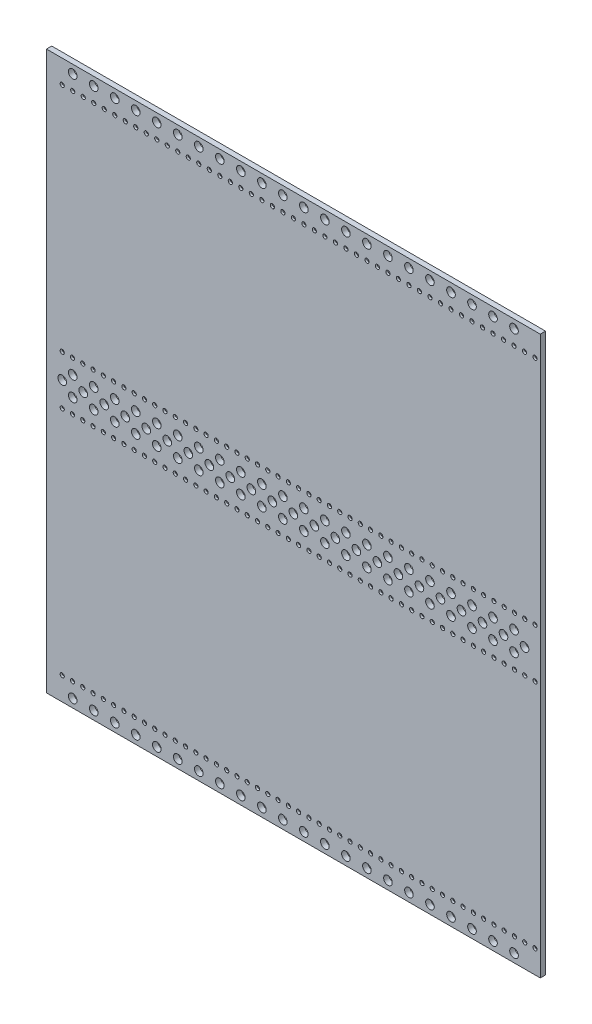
SolidWorks part; units mm, degrees
ref_plane "前视基准面" through (0, 0, 0) normal (0, 0, 1) x (1, 0, 0)
ref_plane "上视基准面" through (0, 0, 0) normal (0, 1, 0) x (1, 0, 0)
ref_plane "右视基准面" through (0, 0, 0) normal (1, 0, 0) x (0, 0, -1)
sketch "草图1" plane through (0, 0, 0) normal (0, 0, 1) x (1, 0, 0)
  line L1 (-117.5, 132.675) -> (117.5, 132.675)
  line L2 (-117.5, 132.675) -> (-117.5, -132.675)
  line L3 (-117.5, -132.675) -> (117.5, -132.675)
  line L4 (117.5, 132.675) -> (117.5, -132.675)
  line L5 (-117.5, 132.675) -> (117.5, -132.675) construction
  line L6 (-117.5, -132.675) -> (117.5, 132.675) construction
  circle A0 centre (-105, 128.675) radius 2.05
  circle A1 centre (-95, 128.675) radius 2.05
  circle A2 centre (-85, 128.675) radius 2.05
  circle A3 centre (-75, 128.675) radius 2.05
  circle A4 centre (-65, 128.675) radius 2.05
  circle A5 centre (-55, 128.675) radius 2.05
  circle A6 centre (-45, 128.675) radius 2.05
  circle A7 centre (-35, 128.675) radius 2.05
  circle A8 centre (-25, 128.675) radius 2.05
  circle A9 centre (-15, 128.675) radius 2.05
  circle A10 centre (-5, 128.675) radius 2.05
  circle A11 centre (5, 128.675) radius 2.05
  circle A12 centre (15, 128.675) radius 2.05
  circle A13 centre (25, 128.675) radius 2.05
  circle A14 centre (35, 128.675) radius 2.05
  circle A15 centre (45, 128.675) radius 2.05
  circle A16 centre (55, 128.675) radius 2.05
  circle A17 centre (65, 128.675) radius 2.05
  circle A18 centre (75, 128.675) radius 2.05
  circle A19 centre (85, 128.675) radius 2.05
  circle A20 centre (95, 128.675) radius 2.05
  circle A21 centre (105, 128.675) radius 2.05
  circle A23 centre (-105, 4.675) radius 2.05
  circle A24 centre (-105, -4.675) radius 2.05
  circle A25 centre (-105, -128.675) radius 2.05
  circle A26 centre (-95, 4.675) radius 2.05
  circle A27 centre (-95, -4.675) radius 2.05
  circle A28 centre (-95, -128.675) radius 2.05
  circle A29 centre (-85, 4.675) radius 2.05
  circle A30 centre (-85, -4.675) radius 2.05
  circle A31 centre (-85, -128.675) radius 2.05
  circle A32 centre (-75, 4.675) radius 2.05
  circle A33 centre (-75, -4.675) radius 2.05
  circle A34 centre (-75, -128.675) radius 2.05
  circle A35 centre (-65, 4.675) radius 2.05
  circle A36 centre (-65, -4.675) radius 2.05
  circle A37 centre (-65, -128.675) radius 2.05
  circle A38 centre (-55, 4.675) radius 2.05
  circle A39 centre (-55, -4.675) radius 2.05
  circle A40 centre (-55, -128.675) radius 2.05
  circle A41 centre (-45, 4.675) radius 2.05
  circle A42 centre (-45, -4.675) radius 2.05
  circle A43 centre (-45, -128.675) radius 2.05
  circle A44 centre (-35, 4.675) radius 2.05
  circle A45 centre (-35, -4.675) radius 2.05
  circle A46 centre (-35, -128.675) radius 2.05
  circle A47 centre (-25, 4.675) radius 2.05
  circle A48 centre (-25, -4.675) radius 2.05
  circle A49 centre (-25, -128.675) radius 2.05
  circle A50 centre (-15, 4.675) radius 2.05
  circle A51 centre (-15, -4.675) radius 2.05
  circle A52 centre (-15, -128.675) radius 2.05
  circle A53 centre (-5, 4.675) radius 2.05
  circle A54 centre (-5, -4.675) radius 2.05
  circle A55 centre (-5, -128.675) radius 2.05
  circle A56 centre (5, 4.675) radius 2.05
  circle A57 centre (5, -4.675) radius 2.05
  circle A58 centre (5, -128.675) radius 2.05
  circle A59 centre (15, 4.675) radius 2.05
  circle A60 centre (15, -4.675) radius 2.05
  circle A61 centre (15, -128.675) radius 2.05
  circle A62 centre (25, 4.675) radius 2.05
  circle A63 centre (25, -4.675) radius 2.05
  circle A64 centre (25, -128.675) radius 2.05
  circle A65 centre (35, 4.675) radius 2.05
  circle A66 centre (35, -4.675) radius 2.05
  circle A67 centre (35, -128.675) radius 2.05
  circle A68 centre (45, 4.675) radius 2.05
  circle A69 centre (45, -4.675) radius 2.05
  circle A70 centre (45, -128.675) radius 2.05
  circle A71 centre (55, 4.675) radius 2.05
  circle A72 centre (55, -4.675) radius 2.05
  circle A73 centre (55, -128.675) radius 2.05
  circle A74 centre (65, 4.675) radius 2.05
  circle A75 centre (65, -4.675) radius 2.05
  circle A76 centre (65, -128.675) radius 2.05
  circle A77 centre (75, 4.675) radius 2.05
  circle A78 centre (75, -4.675) radius 2.05
  circle A79 centre (75, -128.675) radius 2.05
  circle A80 centre (85, 4.675) radius 2.05
  circle A81 centre (85, -4.675) radius 2.05
  circle A82 centre (85, -128.675) radius 2.05
  circle A83 centre (95, 4.675) radius 2.05
  circle A84 centre (95, -4.675) radius 2.05
  circle A85 centre (95, -128.675) radius 2.05
  circle A86 centre (105, 4.675) radius 2.05
  circle A87 centre (105, -4.675) radius 2.05
  circle A88 centre (105, -128.675) radius 2.05
  circle A92 centre (-110, 0) radius 2.05
  circle A93 centre (-100, 0) radius 2.05
  circle A94 centre (-90, 0) radius 2.05
  circle A95 centre (-80, 0) radius 2.05
  circle A96 centre (-70, 0) radius 2.05
  circle A97 centre (-60, 0) radius 2.05
  circle A98 centre (-50, 0) radius 2.05
  circle A99 centre (-40, 0) radius 2.05
  circle A100 centre (-30, 0) radius 2.05
  circle A101 centre (-20, 0) radius 2.05
  circle A102 centre (-10, 0) radius 2.05
  circle A103 centre (0, 0) radius 2.05
  circle A104 centre (10, 0) radius 2.05
  circle A105 centre (20, 0) radius 2.05
  circle A106 centre (30, 0) radius 2.05
  circle A107 centre (40, 0) radius 2.05
  circle A108 centre (50, 0) radius 2.05
  circle A109 centre (60, 0) radius 2.05
  circle A110 centre (70, 0) radius 2.05
  circle A111 centre (80, 0) radius 2.05
  circle A112 centre (90, 0) radius 2.05
  circle A113 centre (100, 0) radius 2.05
  circle A114 centre (110, 0) radius 2.05
  point P0 (0, 0)
extrude "凸台-拉伸1" add sketch "草图1" along normal mid plane 2.5
sketch "草图2" plane through (0, 0, 1.25) normal (0, 0, 1) x (1, 0, 0)
  line L0 (117.5, 132.675) -> (-117.5, 132.675) construction
  line L2 (-117.5, -132.675) -> (117.5, -132.675) construction
  circle A0 centre (-110, 121.675) radius 1
  circle A1 centre (-105, 128.675) radius 2.05 construction
  circle A2 centre (-105, 121.675) radius 1
  circle A3 centre (-100, 121.675) radius 1
  circle A4 centre (-95, 121.675) radius 1
  circle A5 centre (-90, 121.675) radius 1
  circle A6 centre (-85, 121.675) radius 1
  circle A7 centre (-80, 121.675) radius 1
  circle A8 centre (-75, 121.675) radius 1
  circle A9 centre (-70, 121.675) radius 1
  circle A10 centre (-65, 121.675) radius 1
  circle A11 centre (-60, 121.675) radius 1
  circle A12 centre (-55, 121.675) radius 1
  circle A13 centre (-50, 121.675) radius 1
  circle A14 centre (-45, 121.675) radius 1
  circle A15 centre (-40, 121.675) radius 1
  circle A16 centre (-35, 121.675) radius 1
  circle A17 centre (-30, 121.675) radius 1
  circle A18 centre (-25, 121.675) radius 1
  circle A19 centre (-20, 121.675) radius 1
  circle A20 centre (-15, 121.675) radius 1
  circle A21 centre (-10, 121.675) radius 1
  circle A22 centre (-5, 121.675) radius 1
  circle A23 centre (0, 121.675) radius 1
  circle A24 centre (5, 121.675) radius 1
  circle A25 centre (10, 121.675) radius 1
  circle A26 centre (15, 121.675) radius 1
  circle A27 centre (20, 121.675) radius 1
  circle A28 centre (25, 121.675) radius 1
  circle A29 centre (30, 121.675) radius 1
  circle A30 centre (35, 121.675) radius 1
  circle A31 centre (40, 121.675) radius 1
  circle A32 centre (45, 121.675) radius 1
  circle A33 centre (50, 121.675) radius 1
  circle A34 centre (55, 121.675) radius 1
  circle A35 centre (60, 121.675) radius 1
  circle A36 centre (65, 121.675) radius 1
  circle A37 centre (70, 121.675) radius 1
  circle A38 centre (75, 121.675) radius 1
  circle A39 centre (80, 121.675) radius 1
  circle A40 centre (85, 121.675) radius 1
  circle A41 centre (90, 121.675) radius 1
  circle A42 centre (95, 121.675) radius 1
  circle A43 centre (100, 121.675) radius 1
  circle A44 centre (105, 121.675) radius 1
  circle A45 centre (110, 121.675) radius 1
  circle A46 centre (115, 121.675) radius 1
  circle A47 centre (120, 121.675) radius 1
  circle A48 centre (110, 128.675) radius 2.05 construction
  circle A49 centre (-110, 11.675) radius 1
  circle A50 centre (-110, -11.675) radius 1
  circle A51 centre (-110, -121.675) radius 1
  circle A52 centre (-105, -4.675) radius 2.05 construction
  circle A53 centre (-105, 4.675) radius 2.05 construction
  circle A54 centre (-105.1087, 11.675) radius 1
  circle A55 centre (-105.1087, -11.675) radius 1
  circle A56 centre (-105.1087, -121.675) radius 1
  circle A57 centre (-100.2174, 11.675) radius 1
  circle A58 centre (-100.2174, -11.675) radius 1
  circle A59 centre (-100.2174, -121.675) radius 1
  circle A60 centre (-95.3261, 11.675) radius 1
  circle A61 centre (-95.3261, -11.675) radius 1
  circle A62 centre (-95.3261, -121.675) radius 1
  circle A63 centre (-90.4348, 11.675) radius 1
  circle A64 centre (-90.4348, -11.675) radius 1
  circle A65 centre (-90.4348, -121.675) radius 1
  circle A66 centre (-85.5435, 11.675) radius 1
  circle A67 centre (-85.5435, -11.675) radius 1
  circle A68 centre (-85.5435, -121.675) radius 1
  circle A69 centre (-80.6522, 11.675) radius 1
  circle A70 centre (-80.6522, -11.675) radius 1
  circle A71 centre (-80.6522, -121.675) radius 1
  circle A72 centre (-75.7609, 11.675) radius 1
  circle A73 centre (-75.7609, -11.675) radius 1
  circle A74 centre (-75.7609, -121.675) radius 1
  circle A75 centre (-70.8696, 11.675) radius 1
  circle A76 centre (-70.8696, -11.675) radius 1
  circle A77 centre (-70.8696, -121.675) radius 1
  circle A78 centre (-65.9783, 11.675) radius 1
  circle A79 centre (-65.9783, -11.675) radius 1
  circle A80 centre (-65.9783, -121.675) radius 1
  circle A81 centre (-61.087, 11.675) radius 1
  circle A82 centre (-61.087, -11.675) radius 1
  circle A83 centre (-61.087, -121.675) radius 1
  circle A84 centre (-56.1957, 11.675) radius 1
  circle A85 centre (-56.1957, -11.675) radius 1
  circle A86 centre (-56.1957, -121.675) radius 1
  circle A87 centre (-51.3043, 11.675) radius 1
  circle A88 centre (-51.3043, -11.675) radius 1
  circle A89 centre (-51.3043, -121.675) radius 1
  circle A90 centre (-46.413, 11.675) radius 1
  circle A91 centre (-46.413, -11.675) radius 1
  circle A92 centre (-46.413, -121.675) radius 1
  circle A93 centre (-41.5217, 11.675) radius 1
  circle A94 centre (-41.5217, -11.675) radius 1
  circle A95 centre (-41.5217, -121.675) radius 1
  circle A96 centre (-36.6304, 11.675) radius 1
  circle A97 centre (-36.6304, -11.675) radius 1
  circle A98 centre (-36.6304, -121.675) radius 1
  circle A99 centre (-31.7391, 11.675) radius 1
  circle A100 centre (-31.7391, -11.675) radius 1
  circle A101 centre (-31.7391, -121.675) radius 1
  circle A102 centre (-26.8478, 11.675) radius 1
  circle A103 centre (-26.8478, -11.675) radius 1
  circle A104 centre (-26.8478, -121.675) radius 1
  circle A105 centre (-21.9565, 11.675) radius 1
  circle A106 centre (-21.9565, -11.675) radius 1
  circle A107 centre (-21.9565, -121.675) radius 1
  circle A108 centre (-17.0652, 11.675) radius 1
  circle A109 centre (-17.0652, -11.675) radius 1
  circle A110 centre (-17.0652, -121.675) radius 1
  circle A111 centre (-12.1739, 11.675) radius 1
  circle A112 centre (-12.1739, -11.675) radius 1
  circle A113 centre (-12.1739, -121.675) radius 1
  circle A114 centre (-7.2826, 11.675) radius 1
  circle A115 centre (-7.2826, -11.675) radius 1
  circle A116 centre (-7.2826, -121.675) radius 1
  circle A117 centre (-2.3913, 11.675) radius 1
  circle A118 centre (-2.3913, -11.675) radius 1
  circle A119 centre (-2.3913, -121.675) radius 1
  circle A120 centre (2.5, 11.675) radius 1
  circle A121 centre (2.5, -11.675) radius 1
  circle A122 centre (2.5, -121.675) radius 1
  circle A123 centre (7.3913, 11.675) radius 1
  circle A124 centre (7.3913, -11.675) radius 1
  circle A125 centre (7.3913, -121.675) radius 1
  circle A126 centre (12.2826, 11.675) radius 1
  circle A127 centre (12.2826, -11.675) radius 1
  circle A128 centre (12.2826, -121.675) radius 1
  circle A129 centre (17.1739, 11.675) radius 1
  circle A130 centre (17.1739, -11.675) radius 1
  circle A131 centre (17.1739, -121.675) radius 1
  circle A132 centre (22.0652, 11.675) radius 1
  circle A133 centre (22.0652, -11.675) radius 1
  circle A134 centre (22.0652, -121.675) radius 1
  circle A135 centre (26.9565, 11.675) radius 1
  circle A136 centre (26.9565, -11.675) radius 1
  circle A137 centre (26.9565, -121.675) radius 1
  circle A138 centre (31.8478, 11.675) radius 1
  circle A139 centre (31.8478, -11.675) radius 1
  circle A140 centre (31.8478, -121.675) radius 1
  circle A141 centre (36.7391, 11.675) radius 1
  circle A142 centre (36.7391, -11.675) radius 1
  circle A143 centre (36.7391, -121.675) radius 1
  circle A144 centre (41.6304, 11.675) radius 1
  circle A145 centre (41.6304, -11.675) radius 1
  circle A146 centre (41.6304, -121.675) radius 1
  circle A147 centre (46.5217, 11.675) radius 1
  circle A148 centre (46.5217, -11.675) radius 1
  circle A149 centre (46.5217, -121.675) radius 1
  circle A150 centre (51.413, 11.675) radius 1
  circle A151 centre (51.413, -11.675) radius 1
  circle A152 centre (51.413, -121.675) radius 1
  circle A153 centre (56.3043, 11.675) radius 1
  circle A154 centre (56.3043, -11.675) radius 1
  circle A155 centre (56.3043, -121.675) radius 1
  circle A156 centre (61.1957, 11.675) radius 1
  circle A157 centre (61.1957, -11.675) radius 1
  circle A158 centre (61.1957, -121.675) radius 1
  circle A159 centre (66.087, 11.675) radius 1
  circle A160 centre (66.087, -11.675) radius 1
  circle A161 centre (66.087, -121.675) radius 1
  circle A162 centre (70.9783, 11.675) radius 1
  circle A163 centre (70.9783, -11.675) radius 1
  circle A164 centre (70.9783, -121.675) radius 1
  circle A165 centre (75.8696, 11.675) radius 1
  circle A166 centre (75.8696, -11.675) radius 1
  circle A167 centre (75.8696, -121.675) radius 1
  circle A168 centre (80.7609, 11.675) radius 1
  circle A169 centre (80.7609, -11.675) radius 1
  circle A170 centre (80.7609, -121.675) radius 1
  circle A171 centre (85.6522, 11.675) radius 1
  circle A172 centre (85.6522, -11.675) radius 1
  circle A173 centre (85.6522, -121.675) radius 1
  circle A174 centre (90.5435, 11.675) radius 1
  circle A175 centre (90.5435, -11.675) radius 1
  circle A176 centre (90.5435, -121.675) radius 1
  circle A177 centre (95.4348, 11.675) radius 1
  circle A178 centre (95.4348, -11.675) radius 1
  circle A179 centre (95.4348, -121.675) radius 1
  circle A180 centre (100.3261, 11.675) radius 1
  circle A181 centre (100.3261, -11.675) radius 1
  circle A182 centre (100.3261, -121.675) radius 1
  circle A183 centre (105.2174, 11.675) radius 1
  circle A184 centre (105.2174, -11.675) radius 1
  circle A185 centre (105.2174, -121.675) radius 1
  circle A186 centre (110.1087, 11.675) radius 1
  circle A187 centre (110.1087, -11.675) radius 1
  circle A188 centre (110.1087, -121.675) radius 1
  circle A189 centre (115, 11.675) radius 1
  circle A190 centre (115, -11.675) radius 1
  circle A191 centre (115, -121.675) radius 1
  circle A192 centre (110, 4.675) radius 2.05 construction
  dimension "D2" = 5
  dimension "D3" = 2
  dimension "D5" = 7
  dimension "D6" = 5
  dimension "D7" = 11
  dimension "D8" = 7
  dimension "D9" = 7
  dimension "D1" = 11
  dimension "D11" = 5
  dimension "D4" = 47
  dimension "D10" = 47
extrude "切除-拉伸1" cut sketch "草图2" against normal blind 1
sketch "草图3" plane through (0, 0, -1.25) normal (0, 0, -1) x (-1, 0, 0)
  line L0 (-117.5, -132.675) -> (-117.5, 132.675) construction
  circle A0 centre (110, 121.675) radius 1
  circle A1 centre (110, 11.675) radius 1
  circle A2 centre (110, -11.675) radius 1
  circle A3 centre (110, -121.675) radius 1
  circle A4 centre (105.2174, 121.675) radius 1
  circle A5 centre (105.2174, 11.675) radius 1
  circle A6 centre (105.2174, -11.675) radius 1
  circle A7 centre (105.2174, -121.675) radius 1
  circle A8 centre (100.4348, 121.675) radius 1
  circle A9 centre (100.4348, 11.675) radius 1
  circle A10 centre (100.4348, -11.675) radius 1
  circle A11 centre (100.4348, -121.675) radius 1
  circle A12 centre (95.6522, 121.675) radius 1
  circle A13 centre (95.6522, 11.675) radius 1
  circle A14 centre (95.6522, -11.675) radius 1
  circle A15 centre (95.6522, -121.675) radius 1
  circle A16 centre (90.8696, 121.675) radius 1
  circle A17 centre (90.8696, 11.675) radius 1
  circle A18 centre (90.8696, -11.675) radius 1
  circle A19 centre (90.8696, -121.675) radius 1
  circle A20 centre (86.087, 121.675) radius 1
  circle A21 centre (86.087, 11.675) radius 1
  circle A22 centre (86.087, -11.675) radius 1
  circle A23 centre (86.087, -121.675) radius 1
  circle A24 centre (81.3043, 121.675) radius 1
  circle A25 centre (81.3043, 11.675) radius 1
  circle A26 centre (81.3043, -11.675) radius 1
  circle A27 centre (81.3043, -121.675) radius 1
  circle A28 centre (76.5217, 121.675) radius 1
  circle A29 centre (76.5217, 11.675) radius 1
  circle A30 centre (76.5217, -11.675) radius 1
  circle A31 centre (76.5217, -121.675) radius 1
  circle A32 centre (71.7391, 121.675) radius 1
  circle A33 centre (71.7391, 11.675) radius 1
  circle A34 centre (71.7391, -11.675) radius 1
  circle A35 centre (71.7391, -121.675) radius 1
  circle A36 centre (66.9565, 121.675) radius 1
  circle A37 centre (66.9565, 11.675) radius 1
  circle A38 centre (66.9565, -11.675) radius 1
  circle A39 centre (66.9565, -121.675) radius 1
  circle A40 centre (62.1739, 121.675) radius 1
  circle A41 centre (62.1739, 11.675) radius 1
  circle A42 centre (62.1739, -11.675) radius 1
  circle A43 centre (62.1739, -121.675) radius 1
  circle A44 centre (57.3913, 121.675) radius 1
  circle A45 centre (57.3913, 11.675) radius 1
  circle A46 centre (57.3913, -11.675) radius 1
  circle A47 centre (57.3913, -121.675) radius 1
  circle A48 centre (52.6087, 121.675) radius 1
  circle A49 centre (52.6087, 11.675) radius 1
  circle A50 centre (52.6087, -11.675) radius 1
  circle A51 centre (52.6087, -121.675) radius 1
  circle A52 centre (47.8261, 121.675) radius 1
  circle A53 centre (47.8261, 11.675) radius 1
  circle A54 centre (47.8261, -11.675) radius 1
  circle A55 centre (47.8261, -121.675) radius 1
  circle A56 centre (43.0435, 121.675) radius 1
  circle A57 centre (43.0435, 11.675) radius 1
  circle A58 centre (43.0435, -11.675) radius 1
  circle A59 centre (43.0435, -121.675) radius 1
  circle A60 centre (38.2609, 121.675) radius 1
  circle A61 centre (38.2609, 11.675) radius 1
  circle A62 centre (38.2609, -11.675) radius 1
  circle A63 centre (38.2609, -121.675) radius 1
  circle A64 centre (33.4783, 121.675) radius 1
  circle A65 centre (33.4783, 11.675) radius 1
  circle A66 centre (33.4783, -11.675) radius 1
  circle A67 centre (33.4783, -121.675) radius 1
  circle A68 centre (28.6957, 121.675) radius 1
  circle A69 centre (28.6957, 11.675) radius 1
  circle A70 centre (28.6957, -11.675) radius 1
  circle A71 centre (28.6957, -121.675) radius 1
  circle A72 centre (23.913, 121.675) radius 1
  circle A73 centre (23.913, 11.675) radius 1
  circle A74 centre (23.913, -11.675) radius 1
  circle A75 centre (23.913, -121.675) radius 1
  circle A76 centre (19.1304, 121.675) radius 1
  circle A77 centre (19.1304, 11.675) radius 1
  circle A78 centre (19.1304, -11.675) radius 1
  circle A79 centre (19.1304, -121.675) radius 1
  circle A80 centre (14.3478, 121.675) radius 1
  circle A81 centre (14.3478, 11.675) radius 1
  circle A82 centre (14.3478, -11.675) radius 1
  circle A83 centre (14.3478, -121.675) radius 1
  circle A84 centre (9.5652, 121.675) radius 1
  circle A85 centre (9.5652, 11.675) radius 1
  circle A86 centre (9.5652, -11.675) radius 1
  circle A87 centre (9.5652, -121.675) radius 1
  circle A88 centre (4.7826, 121.675) radius 1
  circle A89 centre (4.7826, 11.675) radius 1
  circle A90 centre (4.7826, -11.675) radius 1
  circle A91 centre (4.7826, -121.675) radius 1
  circle A92 centre (0, 121.675) radius 1
  circle A93 centre (0, 11.675) radius 1
  circle A94 centre (0, -11.675) radius 1
  circle A95 centre (0, -121.675) radius 1
  circle A96 centre (-4.7826, 121.675) radius 1
  circle A97 centre (-4.7826, 11.675) radius 1
  circle A98 centre (-4.7826, -11.675) radius 1
  circle A99 centre (-4.7826, -121.675) radius 1
  circle A100 centre (-9.5652, 121.675) radius 1
  circle A101 centre (-9.5652, 11.675) radius 1
  circle A102 centre (-9.5652, -11.675) radius 1
  circle A103 centre (-9.5652, -121.675) radius 1
  circle A104 centre (-14.3478, 121.675) radius 1
  circle A105 centre (-14.3478, 11.675) radius 1
  circle A106 centre (-14.3478, -11.675) radius 1
  circle A107 centre (-14.3478, -121.675) radius 1
  circle A108 centre (-19.1304, 121.675) radius 1
  circle A109 centre (-19.1304, 11.675) radius 1
  circle A110 centre (-19.1304, -11.675) radius 1
  circle A111 centre (-19.1304, -121.675) radius 1
  circle A112 centre (-23.913, 121.675) radius 1
  circle A113 centre (-23.913, 11.675) radius 1
  circle A114 centre (-23.913, -11.675) radius 1
  circle A115 centre (-23.913, -121.675) radius 1
  circle A116 centre (-28.6957, 121.675) radius 1
  circle A117 centre (-28.6957, 11.675) radius 1
  circle A118 centre (-28.6957, -11.675) radius 1
  circle A119 centre (-28.6957, -121.675) radius 1
  circle A120 centre (-33.4783, 121.675) radius 1
  circle A121 centre (-33.4783, 11.675) radius 1
  circle A122 centre (-33.4783, -11.675) radius 1
  circle A123 centre (-33.4783, -121.675) radius 1
  circle A124 centre (-38.2609, 121.675) radius 1
  circle A125 centre (-38.2609, 11.675) radius 1
  circle A126 centre (-38.2609, -11.675) radius 1
  circle A127 centre (-38.2609, -121.675) radius 1
  circle A128 centre (-43.0435, 121.675) radius 1
  circle A129 centre (-43.0435, 11.675) radius 1
  circle A130 centre (-43.0435, -11.675) radius 1
  circle A131 centre (-43.0435, -121.675) radius 1
  circle A132 centre (-47.8261, 121.675) radius 1
  circle A133 centre (-47.8261, 11.675) radius 1
  circle A134 centre (-47.8261, -11.675) radius 1
  circle A135 centre (-47.8261, -121.675) radius 1
  circle A136 centre (-52.6087, 121.675) radius 1
  circle A137 centre (-52.6087, 11.675) radius 1
  circle A138 centre (-52.6087, -11.675) radius 1
  circle A139 centre (-52.6087, -121.675) radius 1
  circle A140 centre (-57.3913, 121.675) radius 1
  circle A141 centre (-57.3913, 11.675) radius 1
  circle A142 centre (-57.3913, -11.675) radius 1
  circle A143 centre (-57.3913, -121.675) radius 1
  circle A144 centre (-62.1739, 121.675) radius 1
  circle A145 centre (-62.1739, 11.675) radius 1
  circle A146 centre (-62.1739, -11.675) radius 1
  circle A147 centre (-62.1739, -121.675) radius 1
  circle A148 centre (-66.9565, 121.675) radius 1
  circle A149 centre (-66.9565, 11.675) radius 1
  circle A150 centre (-66.9565, -11.675) radius 1
  circle A151 centre (-66.9565, -121.675) radius 1
  circle A152 centre (-71.7391, 121.675) radius 1
  circle A153 centre (-71.7391, 11.675) radius 1
  circle A154 centre (-71.7391, -11.675) radius 1
  circle A155 centre (-71.7391, -121.675) radius 1
  circle A156 centre (-76.5217, 121.675) radius 1
  circle A157 centre (-76.5217, 11.675) radius 1
  circle A158 centre (-76.5217, -11.675) radius 1
  circle A159 centre (-76.5217, -121.675) radius 1
  circle A160 centre (-81.3043, 121.675) radius 1
  circle A161 centre (-81.3043, 11.675) radius 1
  circle A162 centre (-81.3043, -11.675) radius 1
  circle A163 centre (-81.3043, -121.675) radius 1
  circle A164 centre (-86.087, 121.675) radius 1
  circle A165 centre (-86.087, 11.675) radius 1
  circle A166 centre (-86.087, -11.675) radius 1
  circle A167 centre (-86.087, -121.675) radius 1
  circle A168 centre (-90.8696, 121.675) radius 1
  circle A169 centre (-90.8696, 11.675) radius 1
  circle A170 centre (-90.8696, -11.675) radius 1
  circle A171 centre (-90.8696, -121.675) radius 1
  circle A172 centre (-95.6522, 121.675) radius 1
  circle A173 centre (-95.6522, 11.675) radius 1
  circle A174 centre (-95.6522, -11.675) radius 1
  circle A175 centre (-95.6522, -121.675) radius 1
  circle A176 centre (-100.4348, 121.675) radius 1
  circle A177 centre (-100.4348, 11.675) radius 1
  circle A178 centre (-100.4348, -11.675) radius 1
  circle A179 centre (-100.4348, -121.675) radius 1
  circle A180 centre (-105.2174, 121.675) radius 1
  circle A181 centre (-105.2174, 11.675) radius 1
  circle A182 centre (-105.2174, -11.675) radius 1
  circle A183 centre (-105.2174, -121.675) radius 1
  circle A184 centre (-110, 121.675) radius 1
  circle A185 centre (-110, 11.675) radius 1
  circle A186 centre (-110, -11.675) radius 1
  circle A187 centre (-110, -121.675) radius 1
  dimension "D1" = 2
  dimension "D2" = 47
  dimension "D3" = 7.5
extrude "凸台-拉伸2" add sketch "草图3" along normal blind 1
equation "\"D6@草图1\"=\"D1@草图1\"/10-2"
equation "\"D12@草图1\"=\"D1@草图1\"/10-2"
equation "\"D16@草图1\"=\"D1@草图1\"/10-0.5"
